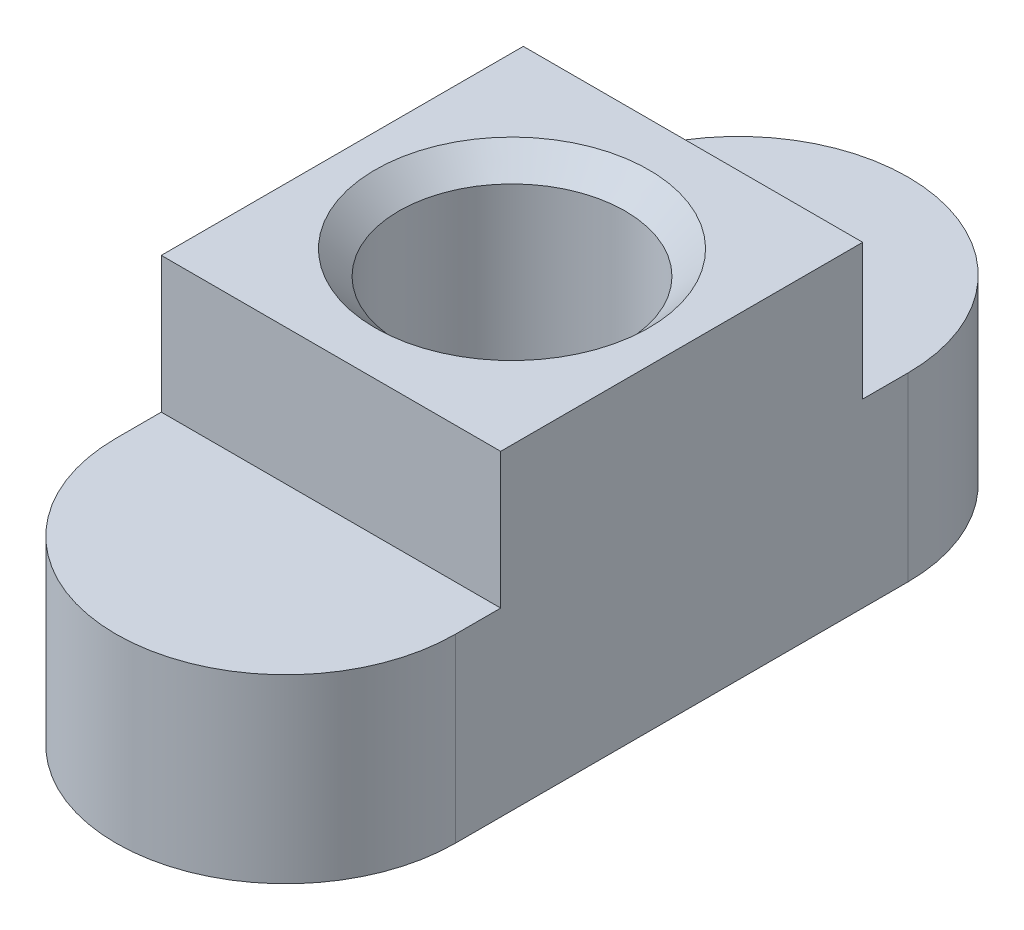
SolidWorks part; units mm, degrees
ref_plane "Ebene vorne" through (0, 0, 0) normal (0, 0, 1) x (1, 0, 0)
ref_plane "Ebene oben" through (0, 0, 0) normal (0, 1, 0) x (1, 0, 0)
ref_plane "Ebene rechts" through (0, 0, 0) normal (1, 0, 0) x (0, 0, -1)
sketch "Skizze1" plane through (0, 0, 0) normal (0, 1, 0) x (1, 0, 0)
  line L0 (0, -5) -> (0, 5) construction
  line L1 (0, -53.599) -> (0, 53.599) construction
  line L2 (-3.75, -5) -> (-3.75, 5)
  line L3 (3.75, -5) -> (3.75, 5)
  arc A0 (-3.75, -5) -> (3.75, -5) centre (0, -5) ccw
  arc A1 (3.75, 5) -> (-3.75, 5) centre (0, 5) ccw
  point P5 (0, 0)
  dimension "D1" = 7.5
  dimension "D2" = 10
extrude "Aufsatz-Linear austragen1" add sketch "Skizze1" along normal blind 4
sketch "Skizze2" plane through (0, 4, 0) normal (0, 1, 0) x (1, 0, 0)
  line L0 (3.75, -5) -> (3.75, 5) construction
  line L1 (-3.75, -4) -> (3.75, -4)
  line L2 (-3.75, -4) -> (-3.75, 4)
  line L3 (-3.75, 4) -> (3.75, 4)
  line L4 (3.75, -4) -> (3.75, 4)
  line L5 (-3.75, -4) -> (3.75, 4) construction
  line L6 (-3.75, 4) -> (3.75, -4) construction
  point P0 (0, 0)
  dimension "D1" = 8
extrude "Aufsatz-Linear austragen2" add sketch "Skizze2" along normal blind 3
hole_wizard "M6 Gewindebohrung1" positions "Skizze3" profile "Skizze4" tap size "M6" standard "DIN"
sketch "Skizze3" plane through (0, 7, 0) normal (0, 1, 0) x (1, 0, 0)
  point P0 (0, 0)
sketch "Skizze4" plane through (0, 7, 0) normal (1, 0, 0) x (0, 0, 1)
  line L0 (0, 0) -> (0, 7)
  line L1 (0, 7) -> (2.5, 7)
  line L2 (2.5, 7) -> (2.5, 0.525)
  line L3 (2.5, 0.525) -> (3.025, 0)
  line L5 (3.025, 0) -> (0, 0)
  line L6 (-2.5, 0.525) -> (-3.025, 0) construction
  line L11 (0, -6.35) -> (0, 107.95) construction
  dimension "Bohrerdurchmesser" = 5
  dimension "Bohrungstiefe" = 7
  dimension "Senkdurchmesser (Oben)" = 6.05
  dimension "Senkwinkel (Oben)" = 90
